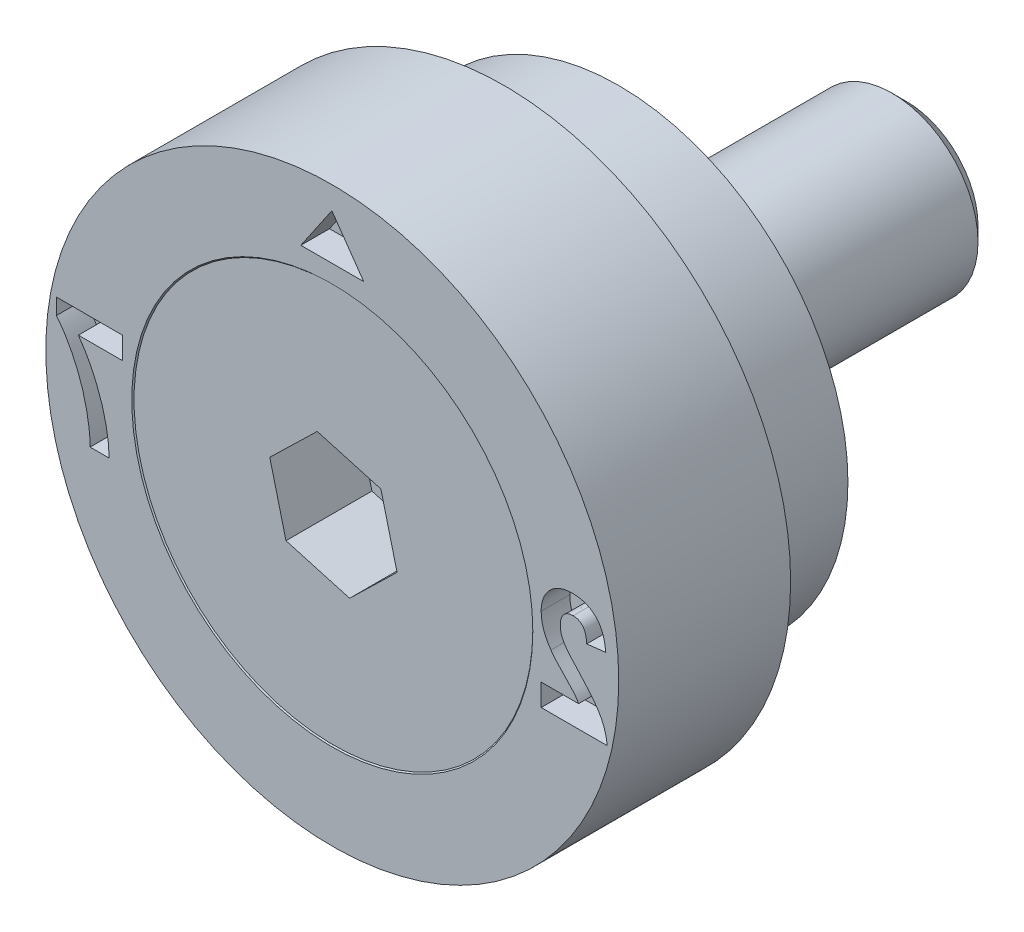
SolidWorks part; units mm, degrees
other "<M3 X .5 FHCS>-<Imported1>"
ref_plane "Front Plane" through (0, 0, 0) normal (0, 0, 1) x (1, 0, 0)
ref_plane "Top Plane" through (0, 0, 0) normal (0, 1, 0) x (1, 0, 0)
ref_plane "Right Plane" through (0, 0, 0) normal (1, 0, 0) x (0, 0, -1)
imported_body "Imported1"
sketch "Sketch1" plane through (0, 0, 0) normal (0, 0, 1) x (1, 0, 0)
  text T0 "2          7" font "Arial" height 2
  dimension "D1" = 1.0795
  dimension "D2" = 4.9022
extrude "Cut-Extrude1" cut sketch "Sketch1" against normal blind 0.5
inserted part "M3 X .5 FHCS"
move or copy body "Body-Move/Copy2" placed by mates yes
